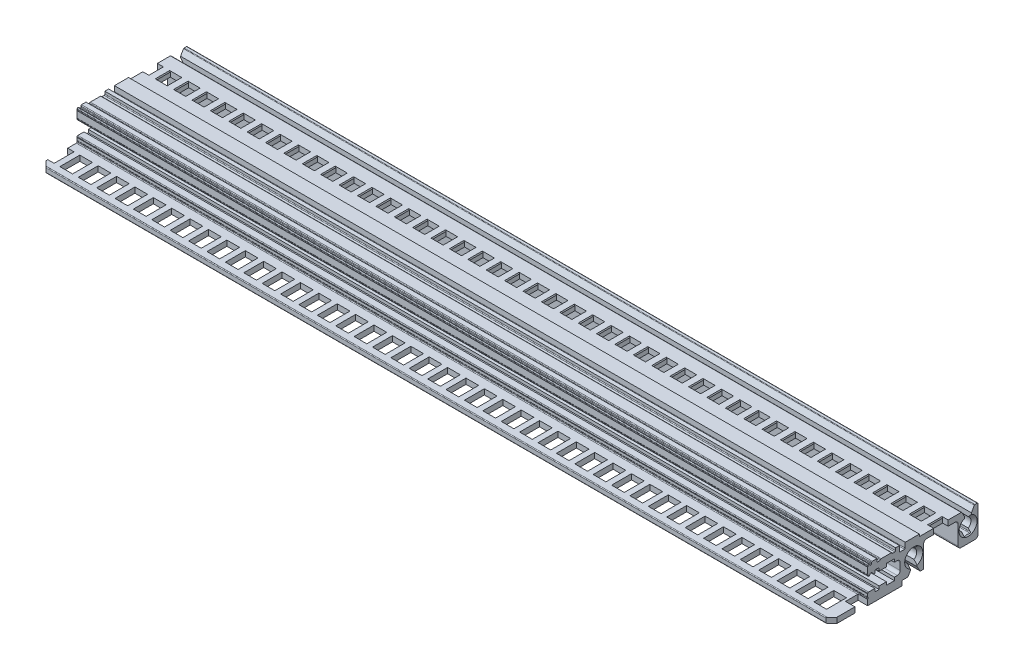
SolidWorks part; units mm, degrees
other "1"
ref_plane "前视基准面" through (0, 0, 0) normal (0, 0, 1) x (1, 0, 0)
ref_plane "上视基准面" through (0, 0, 0) normal (0, 1, 0) x (1, 0, 0)
ref_plane "右视基准面" through (0, 0, 0) normal (1, 0, 0) x (0, 0, -1)
imported_body "输入1"
sketch "草图1" plane through (0, 0, -10.25) normal (0, 0, -1) x (-1, 0, 0)
  line L0 (-215.9, -0.2) -> (-215.9, -7.6) construction
  line L1 (215.9, 11.0552) -> (2.54, 11.0552)
  line L2 (215.9, 11.0552) -> (215.9, -20.327)
  line L3 (215.9, -20.327) -> (2.54, -20.327)
  line L4 (2.54, 11.0552) -> (2.54, -20.327)
  line L5 (215.9, -0.2) -> (215.9, -7.6) construction
  dimension "D1" = 218.44
extrude "切除-拉伸1" cut sketch "草图1" against normal blind 48
sketch "草图2" plane through (0, -7.9, 0) normal (0, 1, 0) x (1, 0, 0)
  line L0 (-2.54, -28.75) -> (-1.04, -30.25)
  line L1 (-2.54, -30.25) -> (-1.04, -30.25)
  line L2 (-2.54, -30.25) -> (-2.54, -28.75)
  dimension "D1" = 1.5
  dimension "D2" = 1.5
extrude "切除-拉伸2" cut sketch "草图2" against normal through all
sketch "草图3" plane through (-2.54, 0, 0) normal (-1, 0, 0) x (0, 0, 1)
  circle A0 centre (7.5, -4.2) radius 1.65
  circle A1 centre (-7.5, -4.2) radius 1.65
extrude "切除-拉伸3" cut sketch "草图3" against normal blind 15.02
chamfer "倒角1" distance 0.85 angle 45 3 edges at (-2.54, -4.2, 9.15) (-2.54, -4.2, 5.85) (-2.54, -4.2, -9.15)
